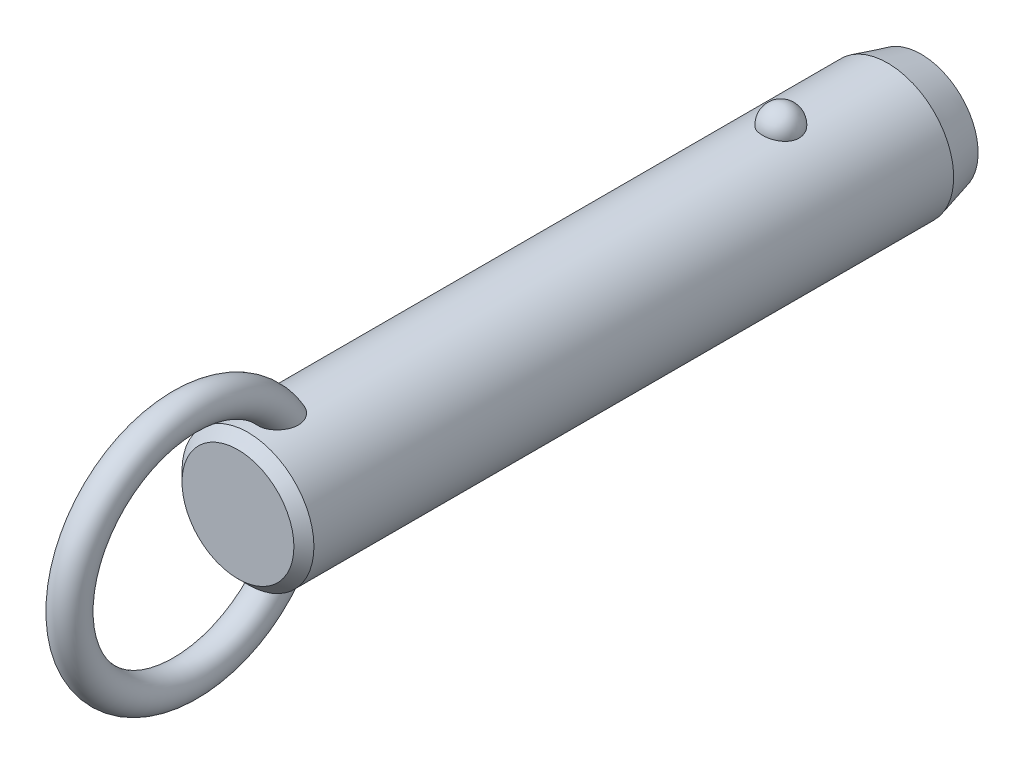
SolidWorks part; units mm, degrees
ref_plane "Front Plane" through (0, 0, 0) normal (0, 0, 1) x (1, 0, 0)
ref_plane "Top Plane" through (0, 0, 0) normal (0, 1, 0) x (1, 0, 0)
ref_plane "Right Plane" through (0, 0, 0) normal (1, 0, 0) x (0, 0, -1)
sketch "Sketch2" plane through (0, 0, 0) normal (0, 0, 1) x (1, 0, 0)
  circle A0 centre (0, 0) radius 7.9
  point P3 (0, 7.9)
  dimension "D1" = 15.8
extrude "Boss-Extrude1" add sketch "Sketch2" along normal blind 53.3
sketch "Sketch3" plane through (0, 0, 0) normal (0, 0, -1) x (-1, 0, 0)
  circle A0 centre (0, 0) radius 7.9
  dimension "D1" = 15.8
extrude "Boss-Extrude2" add sketch "Sketch3" along normal blind 19
chamfer "Chamfer1" distance 4 angle 15 1 edges at (-7.9, 0, -19)
sketch "Sketch12" plane through (0, 0, 0) normal (1, 0, 0) x (0, 0, -1)
  line L0 (-53.3, 7.9) -> (-53.3, -7.9) construction
  point P0 (-53.3, 0)
sketch "Sketch13" plane through (0, 0, 0) normal (1, 0, 0) x (0, 0, -1)
  circle A0 centre (-69.15, 0) radius 15.85
  point P2 (-53.3, 0)
  dimension "D1" = 31.7
sketch "Sketch14" plane through (0, 0, 0) normal (0, 1, 0) x (1, 0, 0)
  circle A0 centre (0, -55.3) radius 2
  point P2 (0, -53.3)
  dimension "D1" = 4
sweep "Sweep1" add profiles "Sketch14" path "Sketch13"
sketch "Sketch15" plane through (0, 0, 53.3) normal (0, 0, 1) x (1, 0, 0)
  circle A0 centre (0, 0) radius 7.9
  dimension "D1" = 15.8
extrude "Boss-Extrude3" add sketch "Sketch15" along normal blind 9.52
chamfer "Chamfer2" distance 1.2 angle 45 1 edges at (7.9, 0, 62.82)
sketch "Sketch18" plane through (0, 0, 0) normal (1, 0, 0) x (0, 0, -1)
  line L0 (15, 7.9) -> (-55.4091, 7.9) construction
  line L1 (2.2, 10.1) -> (2.2, 5.7)
  line L2 (-55.4091, -7.9) -> (15, -7.9) construction
  arc A0 (2.2, 10.1) -> (2.2, 5.7) centre (2.2, 7.9) ccw
  point P4 (0, 7.9)
  dimension "D1" = 18
revolve "Revolve1" add sketch "Sketch18" angle 360 about L1
